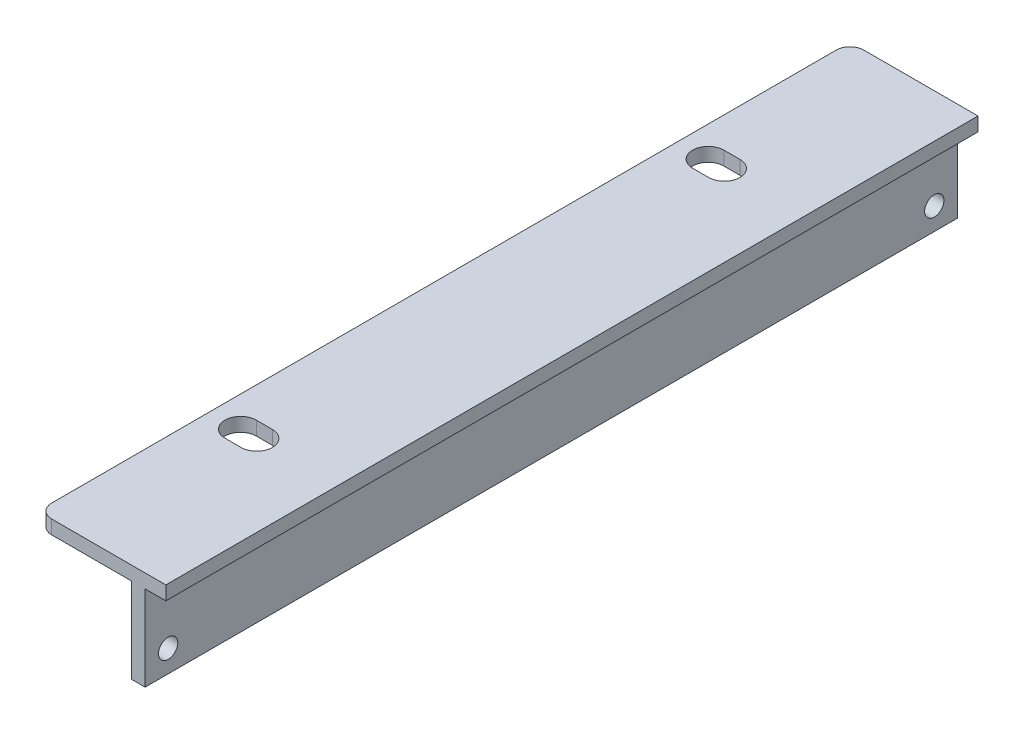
SolidWorks part; units mm, degrees
ref_plane "前视基准面" through (0, 0, 0) normal (0, 0, 1) x (1, 0, 0)
ref_plane "上视基准面" through (0, 0, 0) normal (0, 1, 0) x (1, 0, 0)
ref_plane "右视基准面" through (0, 0, 0) normal (1, 0, 0) x (0, 0, -1)
imported_body "输入1"
sketch "草图1" plane through (0, 0, 0) normal (0, 0, 1) x (1, 0, 0)
  line L0 (-24.8, 0) -> (-27.8, 0)
  line L1 (-27.8, 0) -> (-27.8, -3)
  line L2 (-27.8, -3) -> (-24.8, -3)
  line L8 (-24.8, 0) -> (-24.8, -3)
  line L9 (-24.8, -3) -> (-7.5, -3)
  line L10 (-7.5, -3) -> (-7.5, -21.5)
  line L11 (-7.5, -21.5) -> (-4.5, -21.5)
  line L12 (-4.5, -21.5) -> (-4.5, -3)
  line L13 (-4.5, -3) -> (0, -3)
  line L14 (0, -3) -> (0, 0)
  line L15 (0, 0) -> (-24.8, 0)
  line L17 (-24.8, -3) -> (-7.5, -3)
  line L18 (-7.5, -3) -> (-7.5, -21.5)
  line L19 (-7.5, -21.5) -> (-4.5, -21.5)
  line L20 (-4.5, -21.5) -> (-4.5, -3)
  line L21 (-4.5, -3) -> (0, -3)
  line L22 (0, -3) -> (0, 0)
  line L23 (0, 0) -> (-24.8, 0)
  dimension "D1" = 0
extrude "凸台-拉伸1" add sketch "草图1" along normal blind 176.45
sketch "草图2" plane through (0, 0, 0) normal (0, 1, 0) x (1, 0, 0)
  line L0 (-21.18, -37.425) -> (-17.68, -37.425) construction
  line L1 (-21.18, -34.025) -> (-17.68, -34.025)
  line L2 (-21.18, -40.825) -> (-17.68, -40.825)
  line L3 (-21.18, -139.025) -> (-17.68, -139.025) construction
  line L4 (-21.18, -135.625) -> (-17.68, -135.625)
  line L5 (-21.18, -142.425) -> (-17.68, -142.425)
  line L6 (-27.8, -88.225) -> (28.2462, -88.225) construction
  line L7 (-27.8, -176.45) -> (-27.8, 0) construction
  line L11 (0, -176.45) -> (0, 132) construction
  arc A0 (-21.18, -34.025) -> (-21.18, -40.825) centre (-21.18, -37.425) ccw
  arc A1 (-17.68, -40.825) -> (-17.68, -34.025) centre (-17.68, -37.425) ccw
  arc A2 (-21.18, -135.625) -> (-21.18, -142.425) centre (-21.18, -139.025) ccw
  arc A3 (-17.68, -142.425) -> (-17.68, -135.625) centre (-17.68, -139.025) ccw
  circle A5 centre (-21.18, 94.575) radius 3.4
  point P2 (-19.43, -37.425)
  point P7 (-19.43, -139.025)
  dimension "D1" = 50.8
  dimension "D2" = 50.8
  dimension "D3" = 3.4
  dimension "D4" = 3.4
  dimension "D5" = 3.5
  dimension "D7" = 17.68
  dimension "D8" = 17.68
  dimension "D6" = 3.5
extrude "切除-拉伸1" cut sketch "草图2" against normal blind 176.45
sketch "草图4" plane through (0, 0, 0) normal (0, 1, 0) x (1, 0, 0)
  line L1 (-36.8731, 135.2948) -> (24.0569, 135.2948)
  line L2 (-36.8731, 135.2948) -> (-36.8731, 0)
  line L3 (-36.8731, 0) -> (24.0569, 0)
  line L4 (24.0569, 135.2948) -> (24.0569, 0)
extrude "切除-拉伸2" cut sketch "草图4" against normal through all
fillet "圆角1" radius 3 2 edges at (-27.8, -1.5, 176.45) (-27.8, -1.5, 0)
sketch "草图7" plane through (-4.5, 0, 0) normal (1, 0, 0) x (0, 0, -1)
  line L0 (-176.45, -21.5) -> (-176.45, -3) construction
  line L1 (0, -21.5) -> (-176.45, -21.5) construction
  line L2 (-88.225, 0) -> (-88.225, -16.67) construction
  line L3 (-176.45, 0) -> (0, 0) construction
  circle A0 centre (-171.45, -16.67) radius 2.1
  circle A1 centre (-5, -16.67) radius 2.1
  dimension "D1" = 5
  dimension "D2" = 4.83
extrude "切除-拉伸3" cut sketch "草图7" against normal through all
